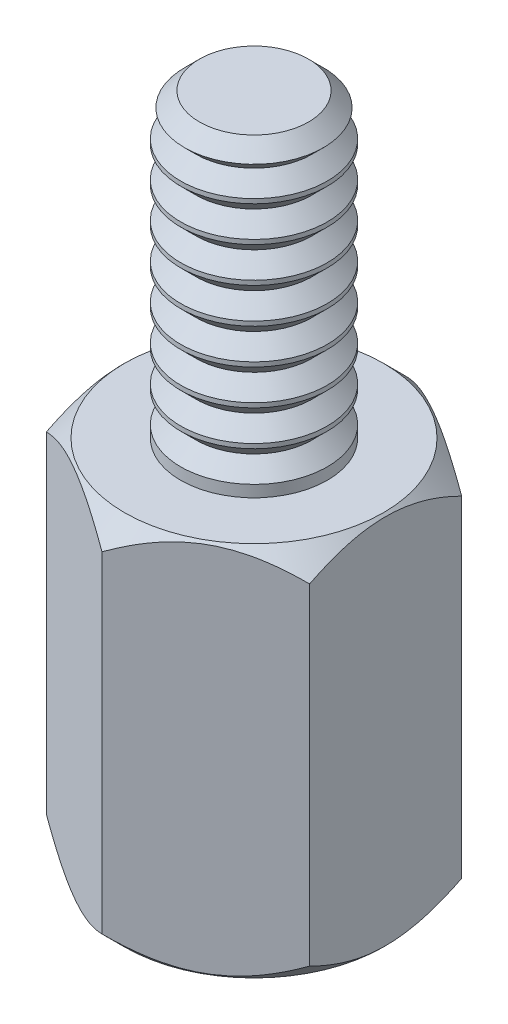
SolidWorks part; units mm, degrees
ref_plane "Plan de face" through (0, 0, 0) normal (0, 0, 1) x (1, 0, 0)
ref_plane "Plan de dessus" through (0, 0, 0) normal (0, 1, 0) x (1, 0, 0)
ref_plane "Plan de droite" through (0, 0, 0) normal (1, 0, 0) x (0, 0, -1)
sketch "Esquisse1" plane through (0, 0, 0) normal (0, 1, 0) x (1, 0, 0)
  line L0 (0, 0) -> (0, 4.0415) construction
  line L1 (0, 4.0415) -> (-3.5, 2.0207)
  line L2 (-3.5, 2.0207) -> (-3.5, -2.0207)
  line L3 (-3.5, -2.0207) -> (0, -4.0415)
  line L4 (0, -4.0415) -> (3.5, -2.0207)
  line L5 (3.5, -2.0207) -> (3.5, 2.0207)
  line L6 (3.5, 2.0207) -> (0, 4.0415)
  circle A0 centre (0, 0) radius 3.5 construction
  dimension "D1" = 7
extrude "Boss.-Extru.1" add sketch "Esquisse1" along normal blind 10
sketch "Esquisse2" plane through (0, 0, 0) normal (1, 0, 0) x (0, 0, -1)
  line L0 (-4.0415, 9.4) -> (-3.4415, 10)
  line L1 (-4.0415, 10) -> (-4.0415, 0) construction
  line L2 (-4.0415, 10) -> (-2.0207, 10) construction
  line L3 (-3.4415, 10) -> (-4.0415, 10)
  line L4 (-4.0415, 10) -> (-4.0415, 9.4)
  line L5 (0, 10) -> (0, 0) construction
  line L6 (-2.0207, 10) -> (2.0207, 10) construction
  line L7 (-4.0415, 5) -> (4.0415, 5) construction
  line L8 (4.0415, 10) -> (4.0415, 0) construction
  line L9 (-4.0415, 0) -> (-4.0415, 0.6)
  line L10 (-3.4415, 0) -> (-4.0415, 0)
  line L11 (-4.0415, 0.6) -> (-3.4415, 0)
  dimension "D1" = 0.6
  dimension "D2" = 0.6
revolve "Enlèvement de matière-Révolution1" cut sketch "Esquisse2" angle 360 about L5
sketch "Esquisse3" plane through (0, 10, 0) normal (0, 1, 0) x (1, 0, 0)
  circle A0 centre (0, 0) radius 1.95
  dimension "D1" = 3.9
extrude "Boss.-Extru.2" add sketch "Esquisse3" along normal blind 8
chamfer "Chanfrein1" distance 0.5 angle 45 1 edges at (0, 18, 1.95)
sketch "Esquisse4" plane through (0, 0, 0) normal (1, 0, 0) x (0, 0, -1)
  line L0 (-1.95, 10.31) -> (-1.5399, 10.7201)
  line L1 (-1.5399, 10.7201) -> (-1.95, 11.1302)
  line L2 (-1.95, 17.5) -> (-1.95, 10) construction
  line L3 (-1.95, 17.5) -> (-1.95, 10) construction
  line L4 (-1.95, 17.5) -> (-1.95, 10) construction
  line L5 (-1.95, 17.5) -> (-1.95, 10) construction
  line L6 (-1.95, 11.1302) -> (-1.95, 10.31)
  line L7 (-1.95, 11.25) -> (-1.5399, 11.6601)
  line L8 (-1.5399, 11.6601) -> (-1.95, 12.0702)
  line L9 (-1.95, 12.0702) -> (-1.95, 11.25)
  line L10 (-1.95, 12.19) -> (-1.5399, 12.6001)
  line L11 (-1.5399, 12.6001) -> (-1.95, 13.0102)
  line L12 (-1.95, 13.0102) -> (-1.95, 12.19)
  line L13 (-1.95, 13.13) -> (-1.5399, 13.5401)
  line L14 (-1.5399, 13.5401) -> (-1.95, 13.9502)
  line L15 (-1.95, 13.9502) -> (-1.95, 13.13)
  line L16 (-1.95, 14.07) -> (-1.5399, 14.4801)
  line L17 (-1.5399, 14.4801) -> (-1.95, 14.8902)
  line L18 (-1.95, 14.8902) -> (-1.95, 14.07)
  line L19 (-1.95, 15.01) -> (-1.5399, 15.4201)
  line L20 (-1.5399, 15.4201) -> (-1.95, 15.8302)
  line L21 (-1.95, 15.8302) -> (-1.95, 15.01)
  line L22 (-1.95, 15.95) -> (-1.5399, 16.3601)
  line L23 (-1.5399, 16.3601) -> (-1.95, 16.7702)
  line L24 (-1.95, 16.7702) -> (-1.95, 15.95)
  line L25 (-1.95, 16.89) -> (-1.5399, 17.3001)
  line L26 (-1.5399, 17.3001) -> (-1.95, 17.7102)
  line L27 (-1.95, 17.7102) -> (-1.95, 16.89)
  line L28 (-1.95, 17.83) -> (-1.5399, 18.2401)
  line L29 (-1.5399, 18.2401) -> (-1.95, 18.6502)
  line L30 (-1.95, 18.6502) -> (-1.95, 17.83)
  line L31 (-1.95, 18.77) -> (-1.5399, 19.1801)
  line L32 (-1.5399, 19.1801) -> (-1.95, 19.5902)
  line L33 (-1.95, 19.5902) -> (-1.95, 18.77)
  line L34 (-1.95, 19.71) -> (-1.5399, 20.1201)
  line L35 (-1.5399, 20.1201) -> (-1.95, 20.5302)
  line L36 (-1.95, 20.5302) -> (-1.95, 19.71)
  line L37 (-1.95, 20.65) -> (-1.5399, 21.0601)
  line L38 (-1.5399, 21.0601) -> (-1.95, 21.4702)
  line L39 (-1.95, 21.4702) -> (-1.95, 20.65)
  line L40 (-1.95, 21.59) -> (-1.5399, 22.0001)
  line L41 (-1.5399, 22.0001) -> (-1.95, 22.4102)
  line L42 (-1.95, 22.4102) -> (-1.95, 21.59)
  line L43 (-1.95, 22.53) -> (-1.5399, 22.9401)
  line L44 (-1.5399, 22.9401) -> (-1.95, 23.3502)
  line L45 (-1.95, 23.3502) -> (-1.95, 22.53)
  line L46 (-1.95, 23.47) -> (-1.5399, 23.8801)
  line L47 (-1.5399, 23.8801) -> (-1.95, 24.2902)
  line L48 (-1.95, 24.2902) -> (-1.95, 23.47)
  line L49 (0, 10) -> (0, 18) construction
  line L50 (3.4415, 10) -> (-3.4415, 10) construction
  line L51 (1.45, 18) -> (-1.45, 18) construction
  dimension "D1" = 0.58
  dimension "D2" = 0.58
  dimension "D3" = 0.31
  dimension "D5" = 0.94
  dimension "D4" = 15
revolve "Enlèvement de matière-Révolution2" cut sketch "Esquisse4" angle 360 about L49
sketch "Esquisse5" plane through (0, 0, 0) normal (0, -1, 0) x (-1, 0, 0)
  circle A0 centre (0, 0) radius 1.95
  circle A2 centre (0, 0) radius 3.4415 construction
  dimension "D1" = 3.9
extrude "Enlèv. mat.-Extru.1" cut sketch "Esquisse5" against normal blind 9
